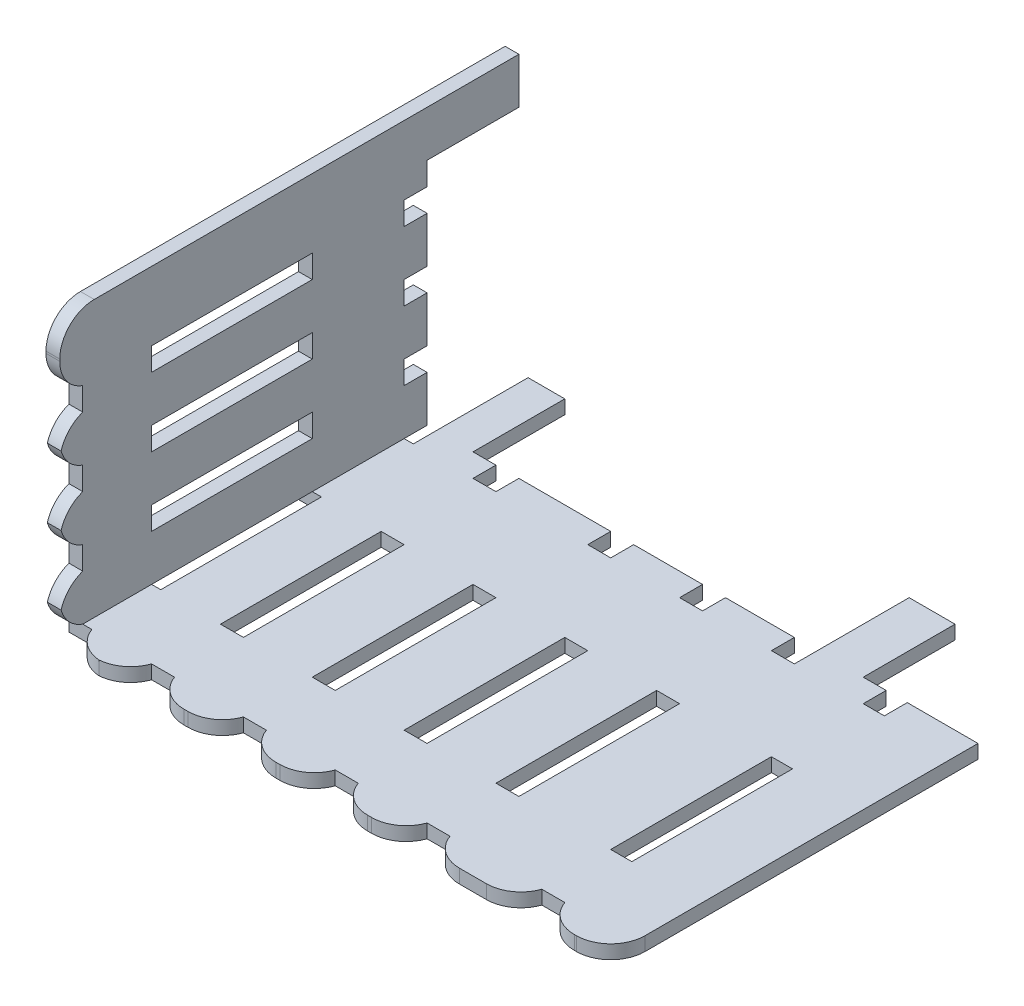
SolidWorks part; units mm, degrees
ref_plane "Plan de face" through (0, 0, 0) normal (0, 0, 1) x (1, 0, 0)
ref_plane "Plan de dessus" through (0, 0, 0) normal (0, 1, 0) x (1, 0, 0)
ref_plane "Plan de droite" through (0, 0, 0) normal (1, 0, 0) x (0, 0, -1)
sketch "Esquisse1" plane through (0, 0, 0) normal (0, 0, 1) x (1, 0, 0)
  line L0 (0, 60) -> (0, 0)
  line L1 (0, 0) -> (120, 0)
extrude "Extru.-Mince1" add sketch "Esquisse1" along normal blind 100 thin
sketch "Esquisse2" plane through (0, -3, 0) normal (0, -1, 0) x (1, 0, 0)
  line L0 (-3, 0) -> (120, 0) construction
  line L1 (120, 0) -> (95, 0)
  line L2 (120, 0) -> (120, 20)
  line L3 (120, 20) -> (95, 20)
  line L4 (95, 0) -> (95, 20)
  line L5 (85, 0) -> (10, 0)
  line L6 (85, 0) -> (85, 20)
  line L7 (85, 20) -> (10, 20)
  line L8 (10, 0) -> (10, 20)
  line L9 (-3, 100) -> (-3, 0) construction
  line L10 (2, 0) -> (-3, 0)
  line L11 (2, 0) -> (2, 20)
  line L12 (2, 20) -> (-3, 20)
  line L13 (-3, 0) -> (-3, 20)
extrude "Extrusion1" cut sketch "Esquisse2" against normal blind 3
sketch "Esquisse3" plane through (0, -3, 0) normal (0, -1, 0) x (1, 0, 0)
  line L0 (-3, 100) -> (-3, 20) construction
  line L1 (2, 20) -> (-3, 20)
  line L2 (2, 20) -> (2, 25)
  line L3 (2, 25) -> (-3, 25)
  line L4 (-3, 20) -> (-3, 25)
  line L5 (85, 20) -> (10, 20) construction
  line L6 (20, 20) -> (15, 20)
  line L7 (20, 20) -> (20, 25)
  line L8 (20, 25) -> (15, 25)
  line L9 (15, 20) -> (15, 25)
  line L10 (-3, 100) -> (120, 100) construction
  line L11 (40, 20) -> (45, 20)
  line L12 (40, 20) -> (40, 25)
  line L13 (40, 25) -> (45, 25)
  line L14 (45, 20) -> (45, 25)
  line L15 (60, 20) -> (65, 20)
  line L16 (60, 20) -> (60, 25)
  line L17 (60, 25) -> (65, 25)
  line L18 (65, 20) -> (65, 25)
  line L19 (80, 20) -> (85, 20)
  line L20 (80, 20) -> (80, 25)
  line L21 (80, 25) -> (85, 25)
  line L22 (85, 20) -> (85, 25)
  line L23 (-3, 80) -> (2, 80)
  line L24 (-3, 80) -> (-3, 45)
  line L25 (-3, 45) -> (2, 45)
  line L26 (2, 80) -> (2, 45)
  line L27 (-3, 100) -> (2, 100)
  line L28 (-3, 100) -> (-3, 95)
  line L29 (-3, 95) -> (2, 95)
  line L30 (2, 100) -> (2, 95)
  line L31 (15, 80) -> (20, 80)
  line L32 (15, 80) -> (15, 45)
  line L33 (15, 45) -> (20, 45)
  line L34 (20, 80) -> (20, 45)
  line L35 (15, 100) -> (20, 100)
  line L36 (15, 100) -> (15, 95)
  line L37 (15, 95) -> (20, 95)
  line L38 (20, 100) -> (20, 95)
  line L39 (120, 20) -> (95, 20) construction
  line L40 (35, 100) -> (40, 100)
  line L41 (35, 100) -> (35, 95)
  line L42 (35, 95) -> (40, 95)
  line L43 (40, 100) -> (40, 95)
  line L44 (55, 100) -> (60, 100)
  line L45 (55, 100) -> (55, 95)
  line L46 (55, 95) -> (60, 95)
  line L47 (60, 100) -> (60, 95)
  line L48 (75, 100) -> (80, 100)
  line L49 (75, 100) -> (75, 95)
  line L50 (75, 95) -> (80, 95)
  line L51 (80, 100) -> (80, 95)
  line L52 (55, 80) -> (60, 80)
  line L53 (55, 80) -> (55, 45)
  line L54 (55, 45) -> (60, 45)
  line L55 (60, 80) -> (60, 45)
  line L56 (75, 80) -> (80, 80)
  line L57 (75, 80) -> (75, 45)
  line L58 (75, 45) -> (80, 45)
  line L59 (80, 80) -> (80, 45)
  line L60 (35, 80) -> (40, 80)
  line L61 (35, 80) -> (35, 45)
  line L62 (35, 45) -> (40, 45)
  line L63 (40, 80) -> (40, 45)
  line L64 (100, 20) -> (104.5974, 20)
  line L65 (100, 20) -> (100, 25)
  line L66 (100, 25) -> (104.5974, 25)
  line L67 (104.5974, 20) -> (104.5974, 25)
  line L69 (100, 45) -> (104.5974, 45)
  line L70 (100, 45) -> (100, 80)
  line L71 (100, 80) -> (104.5974, 80)
  line L72 (104.5974, 45) -> (104.5974, 80)
  line L73 (100, 100) -> (105, 100)
  line L74 (100, 100) -> (100, 95)
  line L75 (100, 95) -> (105, 95)
  line L76 (105, 100) -> (105, 95)
extrude "Extrusion2" cut sketch "Esquisse3" against normal blind 3
fillet "Congé1" radius 7.5 12 edges at (120, -1.5, 100) (105, -1.5, 100) (100, -1.5, 100) (80, -1.5, 100) (75, -1.5, 100) (60, -1.5, 100) (55, -1.5, 100) (40, -1.5, 100) (35, -1.5, 100) (20, -1.5, 100) (15, -1.5, 100) (2, -1.5, 100)
sketch "Esquisse4" plane through (-3, 0, 0) normal (-1, 0, 0) x (0, 0, 1)
  line L1 (0, 0) -> (20, 0)
  line L2 (0, 0) -> (0, 50)
  line L3 (0, 50) -> (20, 50)
  line L4 (20, 0) -> (20, 50)
extrude "Extrusion3" cut sketch "Esquisse4" against normal blind 3
sketch "Esquisse5" plane through (-3, 0, 0) normal (-1, 0, 0) x (0, 0, 1)
  line L0 (20, 0) -> (20, 50) construction
  line L1 (20, 45) -> (25, 45)
  line L2 (20, 45) -> (20, 40)
  line L3 (20, 40) -> (25, 40)
  line L4 (25, 45) -> (25, 40)
  line L5 (100, 60) -> (100, 0) construction
  line L6 (20, 30) -> (25, 30)
  line L7 (20, 30) -> (20, 25)
  line L8 (20, 25) -> (25, 25)
  line L9 (25, 30) -> (25, 25)
  line L10 (20, 15) -> (25, 15)
  line L11 (20, 15) -> (20, 10)
  line L12 (20, 10) -> (25, 10)
  line L13 (25, 15) -> (25, 10)
  line L14 (80, 40) -> (45, 40)
  line L15 (80, 40) -> (80, 45)
  line L16 (80, 45) -> (45, 45)
  line L17 (45, 40) -> (45, 45)
  line L18 (80, 30) -> (45, 30)
  line L19 (80, 30) -> (80, 25)
  line L20 (80, 25) -> (45, 25)
  line L21 (45, 30) -> (45, 25)
  line L22 (80, 15) -> (45, 15)
  line L23 (80, 15) -> (80, 10)
  line L24 (80, 10) -> (45, 10)
  line L25 (45, 15) -> (45, 10)
  line L26 (100, 45) -> (95, 45)
  line L27 (100, 45) -> (100, 40)
  line L28 (100, 40) -> (95, 40)
  line L29 (95, 45) -> (95, 40)
  line L31 (100, 30) -> (95, 30)
  line L32 (100, 30) -> (100, 25)
  line L33 (100, 25) -> (95, 25)
  line L34 (95, 30) -> (95, 25)
  line L35 (100, 15) -> (95, 15)
  line L36 (100, 15) -> (100, 10)
  line L37 (100, 10) -> (95, 10)
  line L38 (95, 15) -> (95, 10)
extrude "Extrusion4" cut sketch "Esquisse5" against normal blind 3
fillet "Congé2" radius 7.5 8 edges at (-1.5, 0, 100) (-1.5, 10, 100) (-1.5, 15, 100) (-1.5, 25, 100) (-1.5, 30, 100) (-1.5, 40, 100) (-1.5, 45, 100) (-1.5, 60, 100)
